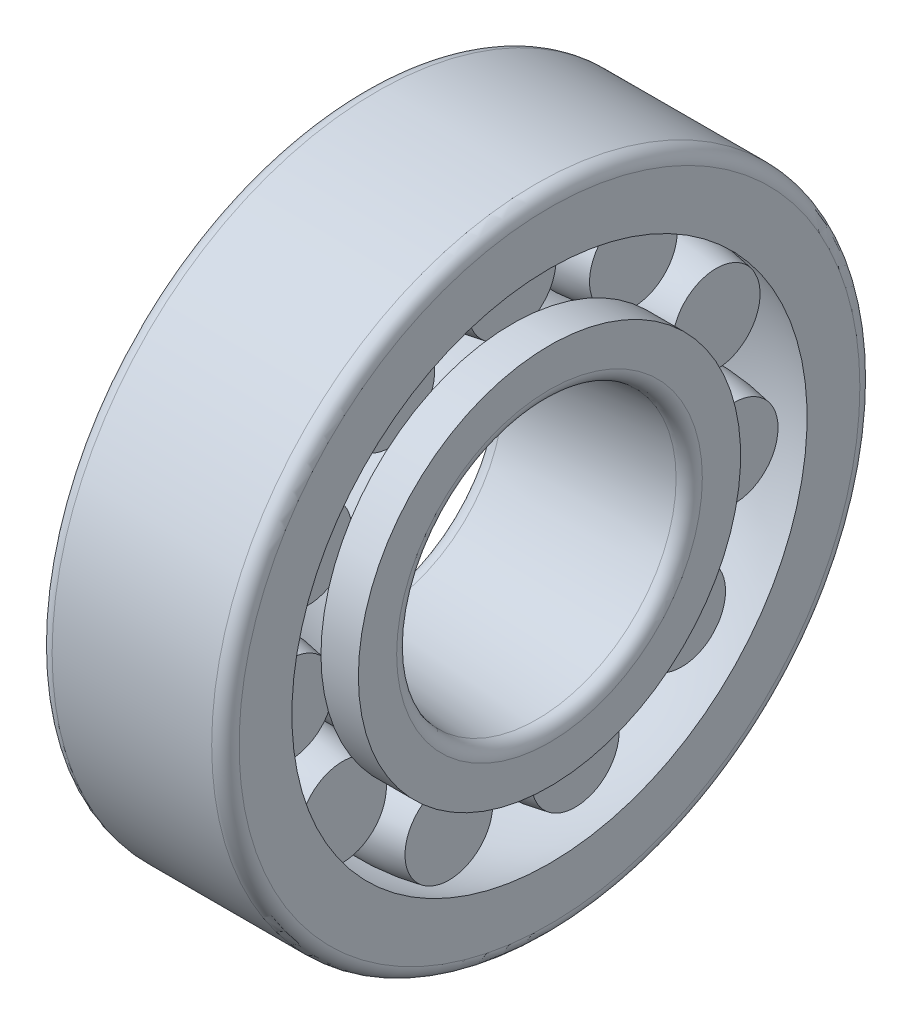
SolidWorks part; units mm, degrees
ref_plane "Front Plane" through (0, 0, 0) normal (0, 0, 1) x (1, 0, 0)
ref_plane "Top Plane" through (0, 0, 0) normal (0, 1, 0) x (1, 0, 0)
ref_plane "Right Plane" through (0, 0, 0) normal (1, 0, 0) x (0, 0, -1)
sketch "Sketch1" plane through (0, 0, 0) normal (0, 0, 1) x (1, 0, 0)
  line L0 (0, 10) -> (0, 26)
  line L1 (0, 26) -> (15, 26)
  line L2 (15, 26) -> (15, 10)
  line L3 (15, 10) -> (0, 10)
  line L4 (0, 0) -> (25.2276, 0) construction
  line L5 (0, 15.3333) -> (3, 15.3333)
  line L6 (3, 15.3333) -> (3, 14.48)
  line L7 (7.5, 26) -> (7.5, 0) construction
  line L8 (12, 15.3333) -> (12, 14.48)
  line L9 (3, 15.3333) -> (12, 15.3333) construction
  line L10 (12, 15.3333) -> (15, 15.3333)
  arc A0 (0, 20.6667) -> (15, 20.6667) centre (7.5, 0) cw
  arc A1 (0, 15.3333) -> (3, 14.48) centre (7.5, 36) ccw construction
  arc A2 (12, 14.48) -> (15, 15.3333) centre (7.5, 36) ccw construction
  arc A3 (3, 14.48) -> (12, 14.48) centre (7.5, 36) ccw
  dimension "D1" = 52
  dimension "d" = 20
  dimension "D2" = 5.3333
  dimension "B" = 15
  dimension "D3" = 5.3333
  dimension "D4" = 9
revolve "Revolve1" add sketch "Sketch1" angle 360 about L4
sketch "Sketch3" plane through (0, 0, 0) normal (0, 0, 1) x (1, 0, 0)
  line L0 (12, 14.48) -> (12, 21.52) construction
  line L1 (12, 18) -> (-2.8807, 18) construction
  line L2 (12, 14.48) -> (12, 18)
  line L3 (3, 14.48) -> (3, 18)
  line L4 (3, 18) -> (12, 18)
  arc A1 (15, 20.6667) -> (0, 20.6667) centre (7.5, 0) ccw construction
  arc A2 (3, 14.48) -> (12, 14.48) centre (7.5, 36) ccw construction
  arc A3 (3, 14.48) -> (12, 14.48) centre (7.5, 36) ccw
revolve "Revolve3" add sketch "Sketch3" angle 360 about L1
pattern_circular "CirPattern3" count 11 over 360 about axis through (0, 0, 0) along (1, 0, 0)
draft "Draft4" type of draft neutral plane draft angle 4.764 faces to draft 1 parameters "D1"=4.764
fillet "Fillet1" radius 1.1 2 edges at (15, 0, 26) (0, 0, 26)
fillet "Fillet2" radius 1.1 2 edges at (0, 0, 10) (15, 0, -11.25)
equation "\"D2@Sketch1\" =( \"D1@Sketch1\" - \"d@Sketch1\") / 6"
equation "\"D3@Sketch1\" =  \"D2@Sketch1\""
equation "\"D4@Sketch1\" = 3 / 5 * \"B@Sketch1\""
equation "\"D1@CirPattern3\" =  ( 3 / 2 )  *  (  ( \"D1@Sketch1\"  +  \"d@Sketch1\" )  /  ( \"D1@Sketch1\" - \"d@Sketch1\" ) )  *  pi  "
equation "\"rs@Fillet2\" = \"rs@Fillet1\""
equation "\"D1@Draft4\" = 90 -  (  arccotan( 1 /12 )  ) "
